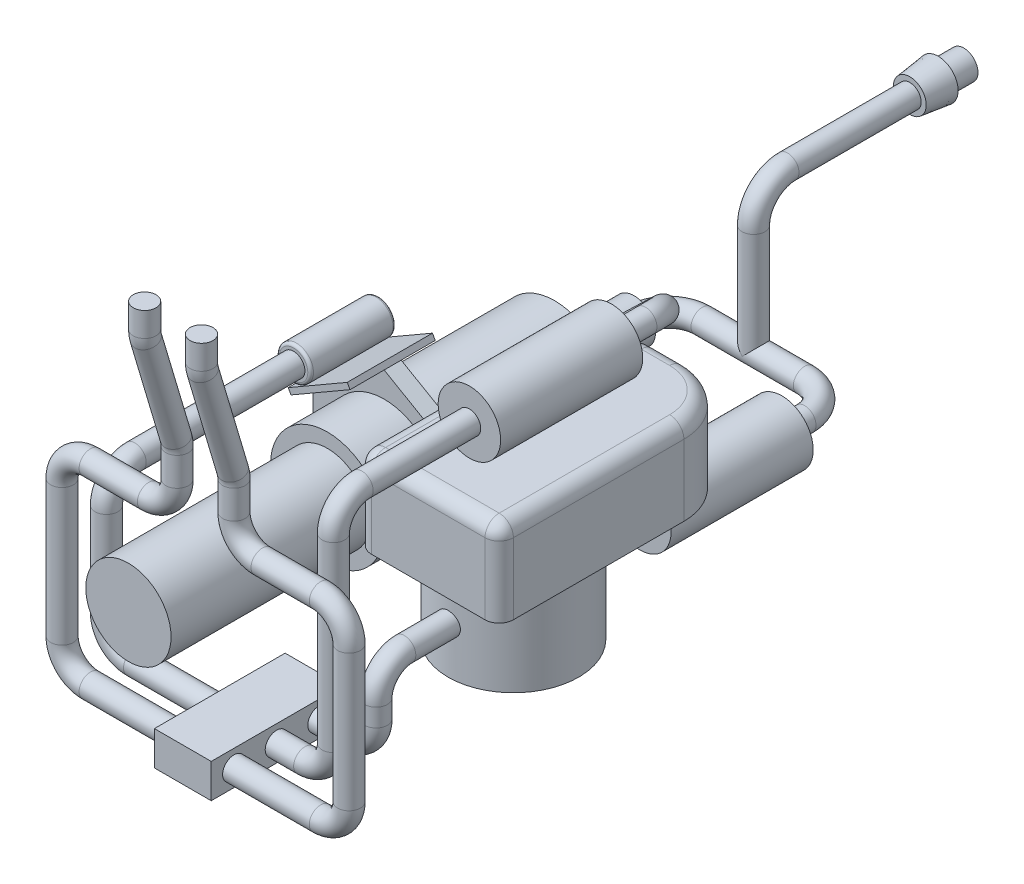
SolidWorks part; units mm, degrees
ref_plane "Plan de face" through (0, 0, 0) normal (0, 0, 1) x (1, 0, 0)
ref_plane "Plan de dessus" through (0, 0, 0) normal (0, 1, 0) x (1, 0, 0)
ref_plane "Plan de droite" through (0, 0, 0) normal (1, 0, 0) x (0, 0, -1)
sketch "Esquisse1" plane through (0, 0, 0) normal (0, 0, 1) x (1, 0, 0)
  line L0 (61.6015, 0) -> (-97.2375, 0) construction
  circle A0 centre (0, 0) radius 15
  dimension "D1" = 30
extrude "Boss.-Extru.1" add sketch "Esquisse1" along normal blind 70
sketch "Esquisse2" plane through (0, 0, 0) normal (0, 0, -1) x (-1, 0, 0)
  circle A0 centre (0, 0) radius 20
  dimension "D1" = 40
extrude "Boss.-Extru.2" add sketch "Esquisse2" along normal blind 80
sketch "Esquisse8" plane through (0, 0, 0) normal (0, 1, 0) x (1, 0, 0)
  line L0 (0, 80) -> (0, 0) construction
  circle A0 centre (60, 5.4851) radius 23
  dimension "D2" = 46
  dimension "D1" = 60
extrude "Boss.-Extru.4" add sketch "Esquisse8" against normal blind 16 and the other way blind 15 separate body
sketch "Esquisse9" plane through (0, 15, 0) normal (0, 1, 0) x (1, 0, 0)
  line L1 (55, 60.4851) -> (65, 60.4851)
  line L2 (35, 40.4851) -> (35, -24.5149)
  line L3 (35, -24.5149) -> (85, -24.5149)
  line L4 (85, 40.4851) -> (85, -24.5149)
  arc A0 (65, 60.4851) -> (85, 40.4851) centre (65, 40.4851) cw
  arc A1 (55, 60.4851) -> (35, 40.4851) centre (55, 40.4851) ccw
  dimension "D5" = 20
  dimension "D1" = 50
  dimension "D2" = 25
  dimension "D3" = 30
  dimension "D4" = 85
extrude "Boss.-Extru.5" add sketch "Esquisse9" along normal blind 30
fillet "Congé1" radius 5 8 edges at (35, 45, -7.9851) (40.8579, 45, -54.6272) (60, 45, -60.4851) (79.1421, 45, -54.6272) (35, 30, 24.5149) (85, 30, 24.5149) (60, 45, 24.5149) (85, 45, -7.9851)
sketch "Esquisse5" plane through (0, 0, -80) normal (0, 0, -1) x (-1, 0, 0)
  circle A0 centre (-60, 58) radius 11
  dimension "D1" = 22
  dimension "D2" = 60
  dimension "D3" = 58
extrude "Boss.-Extru.3" add sketch "Esquisse5" against normal blind 50 from offset 40 separate body
sketch "Esquisse10" plane through (0, 0, 0) normal (0, 1, 0) x (1, 0, 0)
  line L0 (0, 80) -> (0, 108)
  line L1 (20, 80) -> (-20, 80) construction
  line L2 (0, 80) -> (0, 0) construction
  line L3 (12, 120) -> (48, 120)
  line L4 (60, 21.4759) -> (60, 108)
  line L5 (60, -10) -> (60, 40) construction
  arc A0 (60, 108) -> (48, 120) centre (48, 108) ccw
  arc A1 (0, 108) -> (12, 120) centre (12, 108) cw
  point P13 (60, 120)
  point P16 (0, 120)
  dimension "D2" = 12
  dimension "D1" = 40
sketch "Esquisse11" plane through (0, 0, -80) normal (0, 0, -1) x (-1, 0, 0)
  circle A0 centre (0, 0) radius 4
  dimension "D1" = 8
sweep "Balayage1" add profiles "Esquisse11" path "Esquisse10"
ref_plane "Plan1" through (0, 0, 0) normal (-0.695, 0.719, 0) x (-0.719, -0.695, 0)
sketch "Esquisse12" plane through (0, 0, 0) normal (-0.695, 0.719, 0) x (-0.719, -0.695, 0)
  line L0 (-94.4506, -40) -> (-72.4506, -40)
  line L1 (-94.4506, -40) -> (-72.4506, -40) construction
  line L2 (-83.4506, -40) -> (-83.4506, -52)
  line L3 (0, -64) -> (-71.4506, -64)
  arc A0 (-71.4506, -64) -> (-83.4506, -52) centre (-71.4506, -52) cw
  point P7 (-83.4506, -64)
  dimension "D2" = 12
  dimension "D1" = 24
sketch "Esquisse13" plane through (0, 0, -40) normal (0, 0, -1) x (-1, 0, 0)
  circle A0 centre (-60, 58) radius 4
  dimension "D1" = 8
sweep "Balayage2" add profiles "Esquisse13" path "Esquisse12"
ref_plane "Plan2" through (30, 0, 0) normal (1, 0, 0) x (0, 0, -1)
sketch "Esquisse14" plane through (30, 0, 0) normal (1, 0, 0) x (0, 0, -1)
  line L0 (120, 0) -> (120, 38)
  line L1 (132, 50) -> (185, 50)
  arc A0 (120, 38) -> (132, 50) centre (132, 38) cw
  point P7 (120, 50)
  dimension "D3" = 12
  dimension "D1" = 50
  dimension "D2" = 65
sketch "Esquisse15" plane through (0, 0, 0) normal (0, 1, 0) x (1, 0, 0)
  circle A0 centre (30, 120) radius 4
sweep "Balayage3" add profiles "Esquisse15" path "Esquisse14"
sketch "Esquisse16" plane through (0, 0, 0) normal (0, 1, 0) x (1, 0, 0)
  line L0 (30, 132) -> (30, 185) construction
  line L1 (20, -34.8555) -> (40, -34.8555)
  line L2 (20, -34.8555) -> (20, -80.8555)
  line L3 (20, -80.8555) -> (40, -80.8555)
  line L4 (40, -34.8555) -> (40, -80.8555)
  dimension "D1" = 46
  dimension "D2" = 20
  dimension "D3" = 10
extrude "Boss.-Extru.6" add sketch "Esquisse16" against normal blind 12 from offset 20 separate body
sketch "Esquisse17" plane through (40, 0, 0) normal (1, 0, 0) x (0, 0, -1)
  line L0 (-80.8555, -32) -> (-34.8555, -32) construction
  line L1 (-80.8555, -32) -> (-80.8555, -20) construction
  circle A0 centre (-72.8555, -26) radius 4
  dimension "D1" = 8
  dimension "D2" = 6
  dimension "D3" = 8
extrude "Boss.-Extru.7" add sketch "Esquisse17" along normal blind 0.5 and the other way blind 20.5
pattern_linear "Répétition linéaire1" count 3 spacing 15 along (0, 0, -1) of "Boss.-Extru.7"
sketch3d "Esquisse3D2"
  line L0 (60, 58, 10) -> (60, 58, 47.8555)
  line L1 (60, 58, 10) -> (60, 58, -40) construction
  line L2 (60, 48, 57.8555) -> (60, -16, 57.8555)
  line L3 (50, -26, 57.8555) -> (40.5, -26, 57.8555)
  line L4 (40, -26, 57.8555) -> (40.5, -26, 57.8555) construction
  arc A0 (60, -16, 57.8555) -> (50, -26, 57.8555) centre (50, -16, 57.8555) ccw
  arc A1 (60, 58, 47.8555) -> (60, 48, 57.8555) centre (60, 48, 47.8555) ccw
  point P10 (60, -26, 57.8555)
  point P11 (50, -16, 47.8555)
  point P14 (60, 58, 57.8555)
  point P15 (70, 48, 47.8555)
  dimension "D1" = 10
sketch3d "Esquisse3D3"
  line L0 (40.5, -26, 42.8555) -> (50, -26, 42.8555)
  line L1 (40, -26, 42.8555) -> (40.5, -26, 42.8555) construction
  line L2 (60, -16, 42.8555) -> (60, -9.6456, 42.8555)
  line L3 (60, 0.3544, 32.8555) -> (60, 0.3544, -5.4851)
  line L4 (60, 15, -5.4851) -> (60, -16, -5.4851) construction
  arc A0 (50, -26, 42.8555) -> (60, -16, 42.8555) centre (50, -16, 42.8555) ccw
  arc A1 (60, -9.6456, 42.8555) -> (60, 0.3544, 32.8555) centre (60, -9.6456, 32.8555) ccw
  point P10 (60, -26, 42.8555)
  point P11 (50, -16, 52.8555)
  point P14 (60, 0.3544, 42.8555)
  point P15 (50, -9.6456, 32.8555)
  dimension "D1" = 10
sketch "Esquisse18" plane through (40.5, 0, 0) normal (1, 0, 0) x (0, 0, -1)
  circle A1 centre (-57.8555, -26) radius 4
  circle A2 centre (-57.8555, -26) radius 4
  dimension "D1" = 0
sketch "Esquisse19" plane through (40.5, 0, 0) normal (1, 0, 0) x (0, 0, -1)
  circle A1 centre (-42.8555, -26) radius 4
  circle A2 centre (-42.8555, -26) radius 4
  dimension "D1" = 0
sweep "Balayage4" add profiles "Esquisse18" path "Esquisse3D2"
sweep "Balayage5" add profiles "Esquisse19" path "Esquisse3D3"
sketch3d "Esquisse3D4"
  line L0 (19.5, -26, 72.8555) -> (-10.5, -26, 72.8555)
  line L1 (19.5, -26, 72.8555) -> (20, -26, 72.8555) construction
  line L2 (-20.5, -16, 72.8555) -> (-20.5, 32.05, 72.8555)
  line L3 (-10.5, 42.05, 72.8555) -> (10, 42.05, 72.8555)
  line L4 (20, 52.05, 72.8555) -> (20, 62.095, 72.8555)
  line L5 (20, 64.9447, 73.2702) -> (20, 100.5685, 83.8611)
  line L6 (20, 103.4183, 84.2758) -> (20, 111.9632, 84.2758)
  arc A0 (-10.5, -26, 72.8555) -> (-20.5, -16, 72.8555) centre (-10.5, -16, 72.8555) ccw
  arc A1 (10, 42.05, 72.8555) -> (20, 52.05, 72.8555) centre (10, 52.05, 72.8555) ccw
  arc A2 (-20.5, 32.05, 72.8555) -> (-10.5, 42.05, 72.8555) centre (-10.5, 32.05, 72.8555) ccw
  arc A3 (20, 62.095, 72.8555) -> (20, 64.9447, 73.2702) centre (20, 62.095, 82.8555) ccw
  arc A4 (20, 100.5685, 83.8611) -> (20, 103.4183, 84.2758) centre (20, 103.4183, 74.2758) ccw
  point P2 (-20.5, -26, 72.8555)
  point P8 (-10.5, -16, 62.8555)
  point P13 (20, 42.05, 72.8555)
  point P14 (10, 52.05, 82.8555)
  point P17 (-20.5, 42.05, 72.8555)
  point P18 (-10.5, 32.05, 62.8555)
  point P22 (20, 63.55, 72.8555)
  point P25 (30, 62.095, 82.8555)
  point P28 (20, 101.9632, 84.2758)
  point P29 (10, 103.4183, 74.2758)
  dimension "D3" = 10
  dimension "D2" = 10
  dimension "D4" = 10
  dimension "D1" = 40
  dimension "D5" = 68.05
  dimension "D7" = 21.5
  dimension "D6" = 40.5
  dimension "D8" = 10
sketch "Esquisse21" plane through (19.5, 0, 0) normal (-1, 0, 0) x (0, 0, 1)
  circle A1 centre (72.8555, -26) radius 4
  circle A2 centre (72.8555, -26) radius 4
  dimension "D1" = 0
sweep "Balayage6" add profiles "Esquisse21" path "Esquisse3D4"
mirror "Symétrie2" about plane through (30, 0, 0) normal (1, 0, 0) of "Balayage6"
sketch "Esquisse22" plane through (0, 0, 0) normal (0, 0, 1) x (1, 0, 0)
  line L1 (0, 28.8675) -> (-25, 14.4338)
  line L2 (-25, 14.4338) -> (-25, -14.4338)
  line L3 (-25, -14.4338) -> (0, -28.8675)
  line L4 (0, -28.8675) -> (25, -14.4338)
  line L5 (25, -14.4338) -> (25, 14.4338)
  line L6 (25, 14.4338) -> (0, 28.8675)
  circle A0 centre (0, 0) radius 20
  circle A1 centre (0, 0) radius 25 construction
  dimension "D1" = 50
extrude "Boss.-Extru.8" add sketch "Esquisse22" against normal blind 6 from offset 20
sketch "Esquisse23" plane through (-12.5, 21.6506, 0) normal (-0.5, 0.866, 0) x (0.866, 0.5, 0)
  line L0 (14.4338, 26) -> (14.4338, 20) construction
  line L1 (14.4338, 38) -> (-9.5662, 38)
  line L2 (14.4338, 38) -> (14.4338, 8)
  line L3 (14.4338, 8) -> (-9.5662, 8)
  line L4 (-9.5662, 38) -> (-9.5662, 8)
  line L5 (14.4338, 20) -> (-14.4338, 20) construction
  dimension "D1" = 24
  dimension "D2" = 30
  dimension "D3" = 12
extrude "Boss.-Extru.9" add sketch "Esquisse23" along normal blind 2
sketch "Esquisse24" plane through (0, 0, -8) normal (0, 0, 1) x (1, 0, 0)
  line L1 (-21.7846, 18.5996) -> (-1, 30.5996) construction
  circle A1 centre (-19.8714, 26.6439) radius 6
  dimension "D1" = 12
  dimension "D2" = 6.01
extrude "Boss.-Extru.10" add sketch "Esquisse24" against normal up to vertex (30 mm away) separate body
fillet "Congé2" radius 1 2 edges at (-13.8714, 26.6439, -8) (-13.8714, 26.6439, -38)
sketch3d "Esquisse3D7"
  line L0 (-19.8714, 26.6439, -8) -> (-19.8714, 26.6439, 47.8555)
  line L1 (-19.8714, 26.6439, -12.4) -> (-19.8714, 26.6439, -2.2) construction
  line L2 (-19.8714, 16.6439, 57.8555) -> (-19.8714, -16, 57.8555)
  line L3 (-9.8714, -26, 57.8555) -> (20, -26, 57.8555)
  line L4 (19.5, -26, 57.8555) -> (20, -26, 57.8555) construction
  arc A0 (-19.8714, -16, 57.8555) -> (-9.8714, -26, 57.8555) centre (-9.8714, -16, 57.8555) ccw
  arc A1 (-19.8714, 26.6439, 47.8555) -> (-19.8714, 16.6439, 57.8555) centre (-19.8714, 16.6439, 47.8555) ccw
  point P10 (-19.8714, -26, 57.8555)
  point P11 (-9.8714, -16, 67.8555)
  point P14 (-19.8714, 26.6439, 57.8555)
  point P15 (-9.8714, 16.6439, 47.8555)
  dimension "D1" = 10
sketch "Esquisse27" plane through (0, 0, -8) normal (0, 0, 1) x (1, 0, 0)
  circle A0 centre (-19.8714, 26.6439) radius 4
  dimension "D1" = 8
sweep "Balayage15" add profiles "Esquisse27" path "Esquisse3D7"
sketch "Esquisse28" plane through (0, 0, -185) normal (0, 0, -1) x (-1, 0, 0)
  circle A2 centre (-30, 50) radius 7
  circle A3 centre (-30, 50) radius 7
  dimension "D1" = 3
extrude "Boss.-Extru.11" add sketch "Esquisse28" against normal blind 10 draft 7
sketch "Esquisse29" plane through (0, 0, -185) normal (0, 0, -1) x (-1, 0, 0)
  circle A0 centre (-30, 50) radius 5
  dimension "D1" = 10
extrude "Boss.-Extru.12" add sketch "Esquisse29" along normal blind 9
sketch "Esquisse30" plane through (0, 0, -80) normal (0, 0, -1) x (-1, 0, 0)
  circle A0 centre (-60, 0) radius 11
  dimension "D1" = 22
extrude "Boss.-Extru.13" add sketch "Esquisse30" along normal blind 20 and the other way blind 30 separate body
sketch "Esquisse31" plane through (0, 0, -80) normal (0, 0, -1) x (-1, 0, 0)
  circle A0 centre (0, 0) radius 7.5
  dimension "D1" = 15
extrude "Boss.-Extru.14" add sketch "Esquisse31" along normal blind 20 from offset 8 separate body
